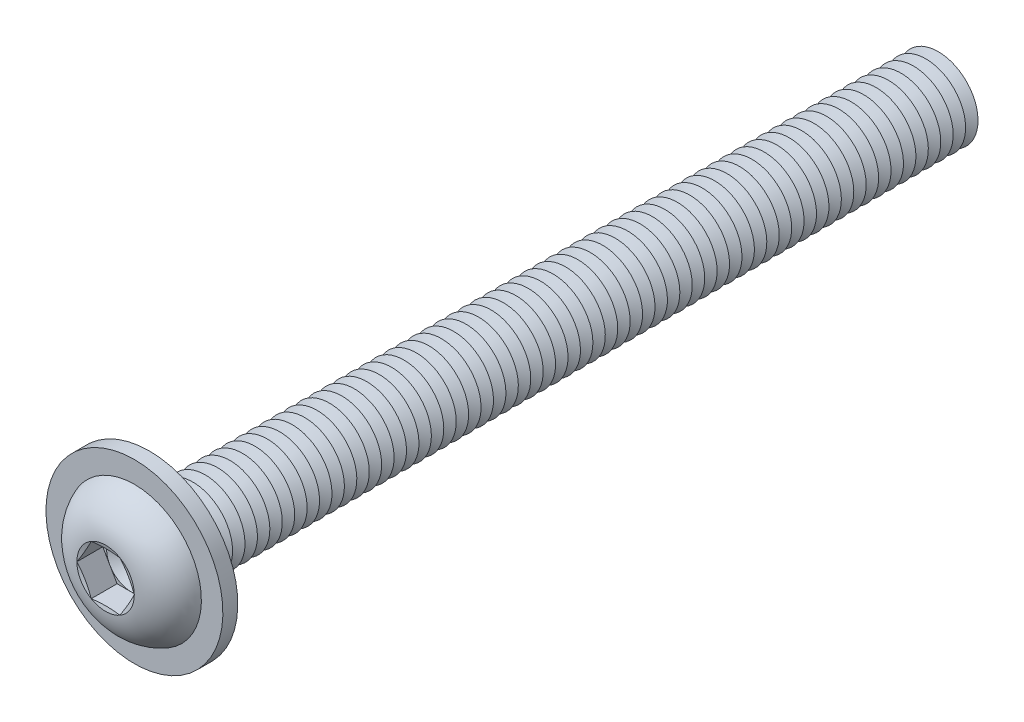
SolidWorks part; units mm, degrees
ref_plane "Front Plane" through (0, 0, 0) normal (0, 0, 1) x (1, 0, 0)
ref_plane "Top Plane" through (0, 0, 0) normal (0, 1, 0) x (1, 0, 0)
ref_plane "Right Plane" through (0, 0, 0) normal (1, 0, 0) x (0, 0, -1)
sketch "Sketch1" plane through (0, 0, 0) normal (1, 0, 0) x (0, 0, -1)
  line L0 (0, 4) -> (0, 7)
  line L3 (0, 4) -> (80, 4)
  line L4 (80, 4) -> (80, 0)
  line L5 (80, 0) -> (-4.4, 0) construction
  line L6 (-4.4, 0) -> (80, 0)
  line L7 (-4.4, 2.8867) -> (-4.4, 1.4434) construction
  line L8 (-4.4, 1.4434) -> (-4.4, 0)
  line L9 (-4.4, 2.8867) -> (-4.0132, 1.4434)
  line L10 (-4.0132, 1.4434) -> (-4.4, 1.4434)
  line L11 (80, 0) -> (22.7481, 0) construction
  line L12 (0, 7) -> (-4.4, 7) construction
  arc A1 (0, 7) -> (-4.4, 2.8867) centre (0, 2.59) ccw
  point P8 (80, 2)
  dimension "D1" = 14
  dimension "D2" = 8
  dimension "D3" = 4.4
  dimension "D4" = 5.7735
  dimension "D5" = 80
  dimension "D6" = 15
revolve "Revolve1" add sketch "Sketch1" angle 360 about L5
fillet "Fillet1" radius 0.625 1 edges at (0, 4, 0)
sketch "Sketch2" plane through (0, 0, 0) normal (1, 0, 0) x (0, 0, -1)
  line L0 (79.375, 4) -> (80.625, 4)
  line L1 (80, 4) -> (0.625, 4) construction
  line L2 (80.625, 4) -> (80, 2.9175)
  line L3 (80, -4) -> (80, 4) construction
  line L4 (80, 2.9175) -> (79.375, 4)
  dimension "D1" = 1.25
revolve "Cut-Revolve1" cut sketch "Sketch2" angle 360 about axis through (0, 0, -80) along (0, 0, -1)
pattern_linear "LPattern1" count 64 spacing 1.25 along (0, 0, 1) of "Cut-Revolve1"
sketch "Sketch3" plane through (0, 0, 4.4) normal (0, 0, 1) x (1, 0, 0)
  line L7 (1.4434, 2.5) -> (-1.4434, 2.5)
  line L8 (-1.4434, 2.5) -> (-2.8867, 0)
  line L9 (-2.8867, 0) -> (-1.4434, -2.5)
  line L10 (-1.4434, -2.5) -> (1.4434, -2.5)
  line L11 (1.4434, -2.5) -> (2.8867, 0)
  line L12 (2.8867, 0) -> (1.4434, 2.5)
  circle A0 centre (0, 0) radius 2.5 construction
  circle A3 centre (0, 0) radius 2.8867 construction
extrude "Cut-Extrude1" cut sketch "Sketch3" against normal blind 2.6
sketch "Sketch4" plane through (0, 0, 1.8) normal (0, 0, 1) x (1, 0, 0)
  line L1 (1.4434, 2.5) -> (-1.4434, 2.5) construction
  circle A0 centre (0, 0) radius 2.5
extrude "Cut-Extrude2" cut sketch "Sketch4" against normal through all draft 60
sketch "Sketch5" plane through (0, 0, 0) normal (0, 0, -1) x (-1, 0, 0)
  circle A0 centre (0, 0) radius 8.9
  circle A1 centre (0, 0) radius 4.625
  circle A2 centre (0, 0) radius 4.625 construction
  dimension "D1" = 17.8
extrude "Boss-Extrude1" add sketch "Sketch5" against normal blind 1.5
